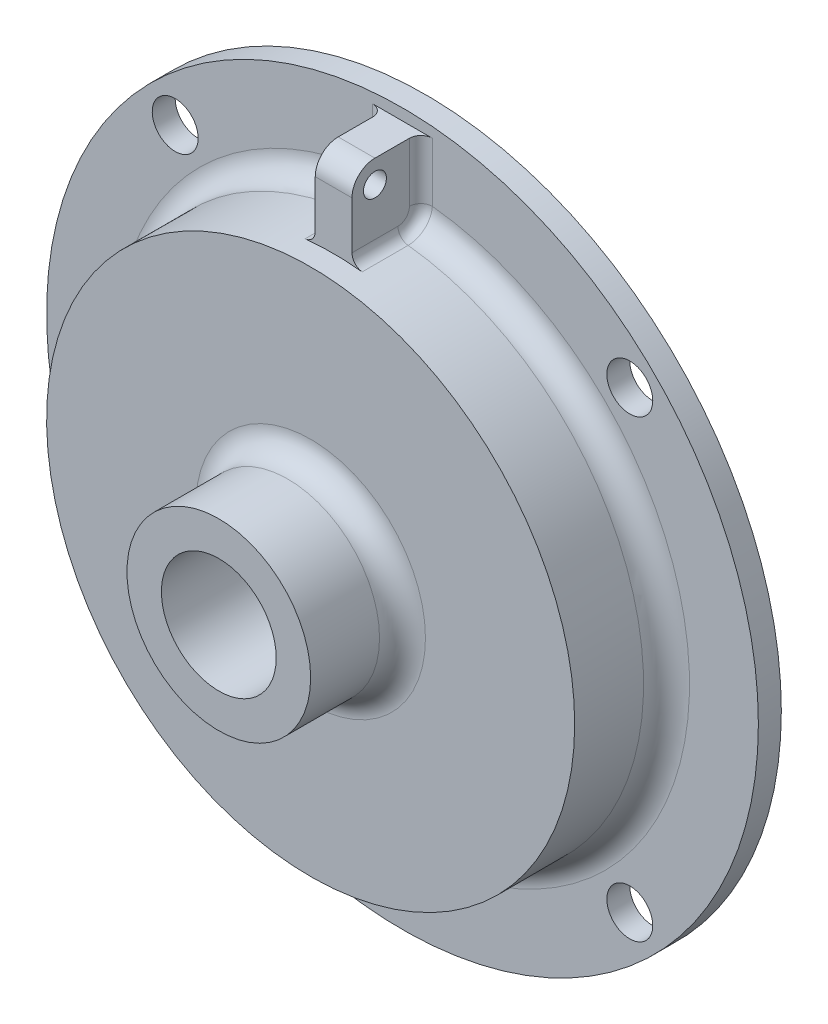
SolidWorks part; units mm, degrees
ref_plane "Front" through (0, 0, 0) normal (0, 0, 1) x (1, 0, 0)
ref_plane "Top" through (0, 0, 0) normal (0, 1, 0) x (1, 0, 0)
ref_plane "Right" through (0, 0, 0) normal (1, 0, 0) x (0, 0, -1)
sketch "Sketch1" plane through (0, 0, 0) normal (0, 0, 1) x (1, 0, 0)
  circle A0 centre (0, 0) radius 49.2125
  dimension "D1" = 98.425
extrude "Base-Extrude" add sketch "Sketch1" along normal blind 3.175
sketch "Sketch5" plane through (0, 0, 3.175) normal (0, 0, 1) x (1, 0, 0)
  line L0 (31.4309, 31.4309) -> (0, 0) construction
  line L1 (0, 0) -> (44.45, 0) construction
  circle A0 centre (0, 0) radius 44.45 construction
  circle A1 centre (31.4309, 31.4309) radius 3.175
  dimension "D1" = 88.9
  dimension "D2" = 6.35
  dimension "D3" = 45
extrude "Cut-Extrude2" cut sketch "Sketch5" against normal through all
pattern_circular "CirPattern1" count 4 every 90 about axis through (0, 0, 0) along (0, 0, 1) of "Cut-Extrude2"
sketch "Sketch2" plane through (0, 0, 3.175) normal (0, 0, 1) x (1, 0, 0)
  circle A0 centre (0, 0) radius 36.5125
  dimension "D1" = 73.025
extrude "Boss-Extrude1" add sketch "Sketch2" along normal blind 12.7
sketch "Sketch3" plane through (0, 0, 15.875) normal (0, 0, 1) x (1, 0, 0)
  circle A0 centre (0, 0) radius 12.7
  dimension "D1" = 25.4
extrude "Boss-Extrude2" add sketch "Sketch3" along normal blind 12.7
fillet "Fillet1" radius 3.175 2 edges at (36.5125, 0, 3.175) (12.7, 0, 15.875)
sketch "Sketch6" plane through (0, 0, 0) normal (0, 1, 0) x (1, 0, 0)
  line L0 (-2.54, -3.175) -> (-2.54, -12.7)
  line L1 (-39.6875, -3.175) -> (39.6875, -3.175) construction
  line L2 (-2.54, -3.175) -> (2.54, -3.175)
  line L3 (-49.2125, -3.175) -> (49.2125, -3.175) construction
  line L4 (2.54, -3.175) -> (2.54, -12.7)
  line L5 (-2.54, -12.7) -> (2.54, -12.7)
  line L6 (0, 0) -> (0, -38.11) construction
  line L7 (0, -3.175) -> (0, 0) construction
  dimension "D1" = 5.08
  dimension "D2" = 9.525
extrude "Boss-Extrude3" add sketch "Sketch6" along normal blind 47.625
sketch "Sketch4" plane through (0, 0, 28.575) normal (0, 0, 1) x (1, 0, 0)
  circle A0 centre (0, 0) radius 7.9375
  dimension "D1" = 15.875
extrude "Cut-Extrude1" cut sketch "Sketch4" against normal through all
fillet "Fillet2" radius 3.175 1 edges at (0, 47.625, 12.7)
sketch "Sketch7" plane through (2.54, 0, 0) normal (1, 0, 0) x (0, 0, -1)
  circle A0 centre (-9.525, 44.45) radius 1.5875
  arc A1 (-9.525, 47.625) -> (-12.7, 44.45) centre (-9.525, 44.45) ccw construction
  dimension "D1" = 3.175
extrude "Cut-Extrude3" cut sketch "Sketch7" against normal up to next
fillet "Fillet3" radius 1.5875 6 edges at (2.54, 41.6917, 8.7475) (-2.54, 41.6917, 8.7475) (2.54, 43.6156, 3.175) (-2.54, 36.424, 9.525) (-2.54, 43.6156, 3.175) (2.54, 36.424, 9.525)
